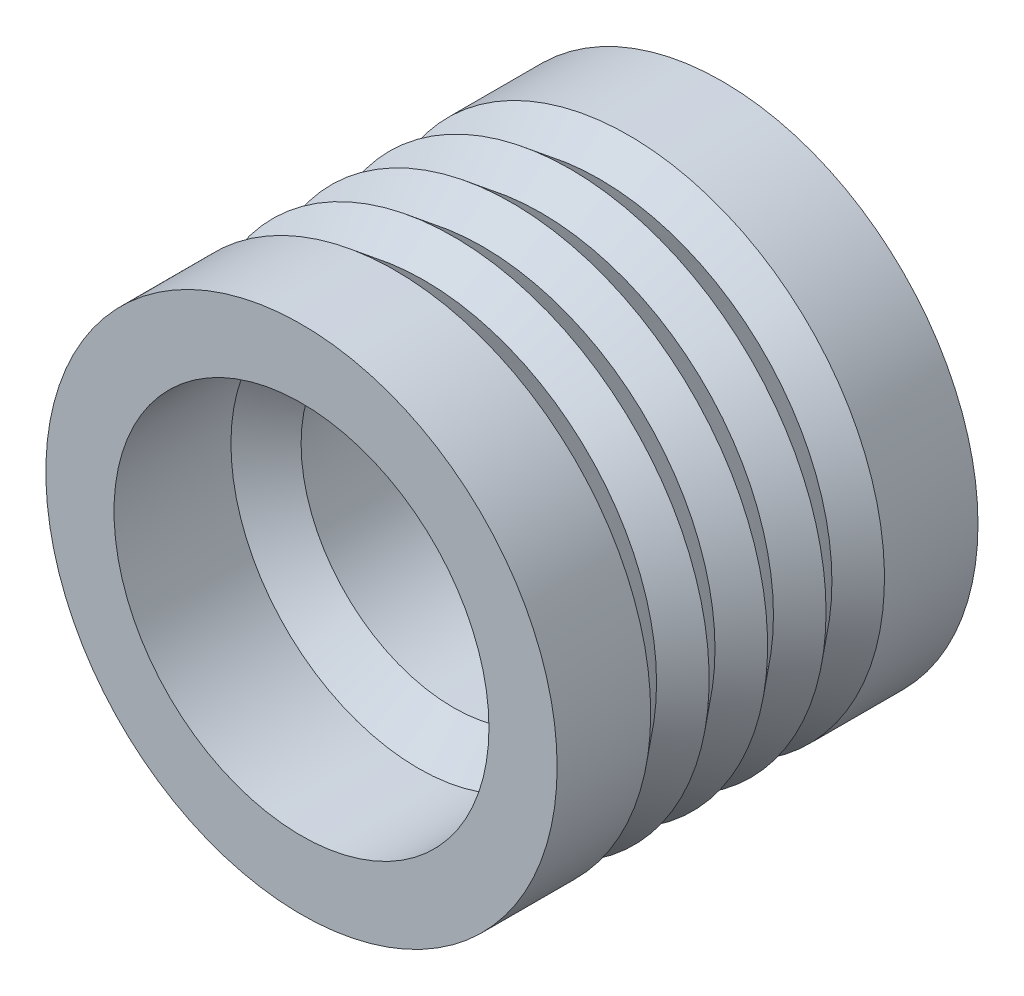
SolidWorks part; units mm, degrees
ref_plane "Alzado" through (0, 0, 0) normal (0, 0, 1) x (1, 0, 0)
ref_plane "Planta" through (0, 0, 0) normal (0, 1, 0) x (1, 0, 0)
ref_plane "Vista lateral" through (0, 0, 0) normal (1, 0, 0) x (0, 0, -1)
other "Graphic1"
other "Graphic (Closed) -1"
imported_body "Imported1"
other "Convert Mesh to Standard1"
scale "Scale1" bodies to scale 101 scale about centroid uniform scaling yes scale factor 1.375
